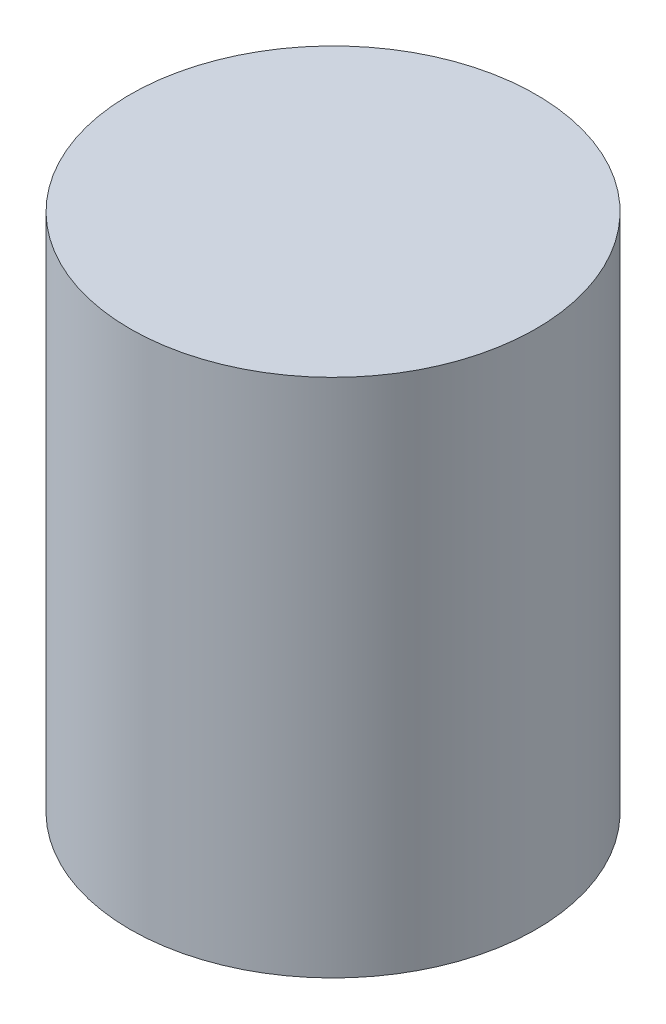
SolidWorks part; units mm, degrees
ref_plane "Front" through (0, 0, 0) normal (0, 0, 1) x (1, 0, 0)
ref_plane "Top" through (0, 0, 0) normal (0, 1, 0) x (1, 0, 0)
ref_plane "Right" through (0, 0, 0) normal (1, 0, 0) x (0, 0, -1)
sketch "Sketch1"
  dimension "D1" = 65.5515
  dimension "D2" = 68.4136
  dimension "D3" = 83.2359
extrude "Extrude1" add sketch "Sketch1" along normal blind 84
